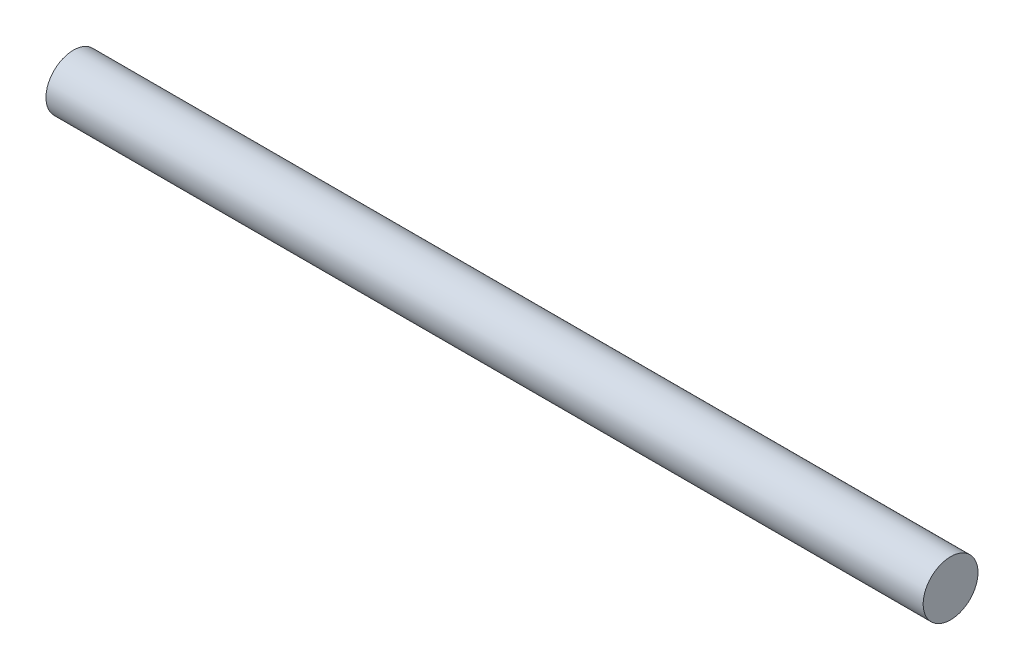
SolidWorks part; units mm, degrees
ref_plane "Front Plane" through (0, 0, 0) normal (0, 0, 1) x (1, 0, 0)
ref_plane "Top Plane" through (0, 0, 0) normal (0, 1, 0) x (1, 0, 0)
ref_plane "Right Plane" through (0, 0, 0) normal (1, 0, 0) x (0, 0, -1)
sketch "Sketch1" plane through (0, 0, 0) normal (1, 0, 0) x (0, 0, -1)
  circle A0 centre (0, 0) radius 12.7
  dimension "D1" = 25.4
extrude "Boss-Extrude1" add sketch "Sketch1" along normal blind 406.4
